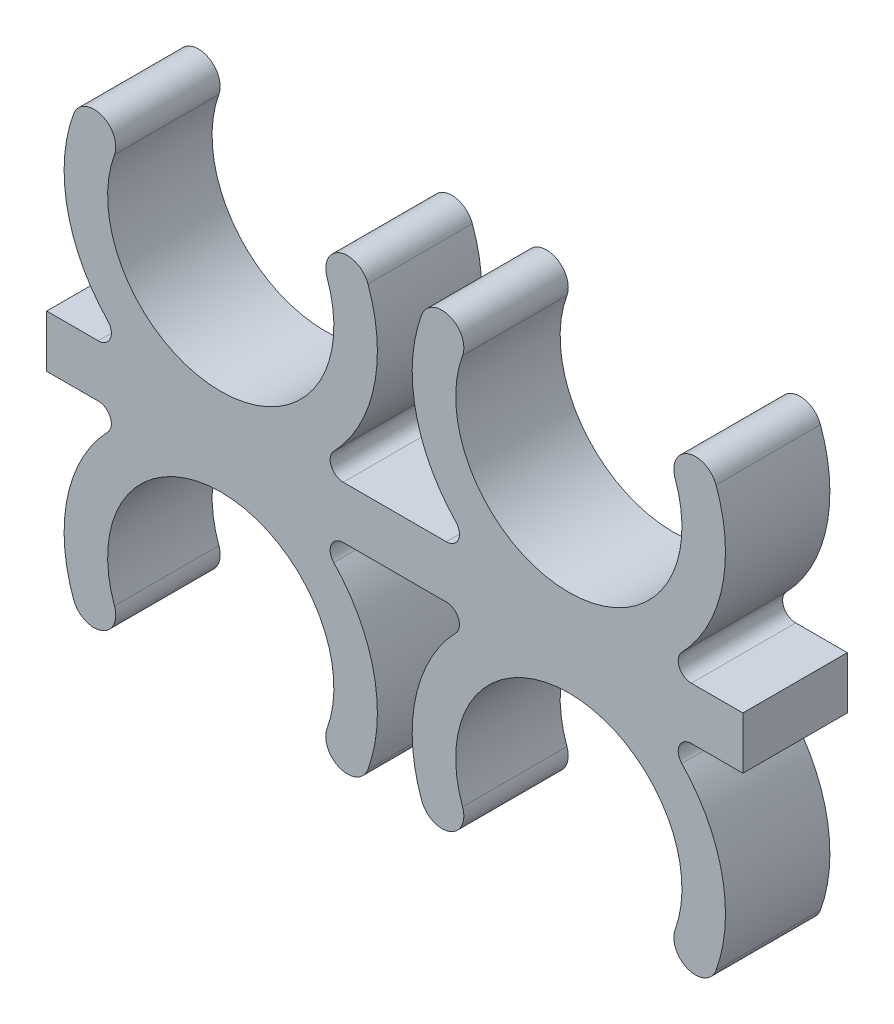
SolidWorks part; units mm, degrees
ref_plane "Front" through (0, 0, 0) normal (0, 0, 1) x (1, 0, 0)
ref_plane "Top" through (0, 0, 0) normal (0, 1, 0) x (1, 0, 0)
ref_plane "Right" through (0, 0, 0) normal (1, 0, 0) x (0, 0, -1)
sketch "Sketch1" plane through (0, 0, 0) normal (0, 0, 1) x (1, 0, 0)
  line L0 (0, -6.5) -> (0, -13.5)
  line L1 (0, 0) -> (-6.108, 2.2231) construction
  line L3 (0, -13.5) -> (-4, -13.5)
  line L4 (-4, -13.5) -> (-4, -10.5)
  line L5 (-4, -10.5) -> (-3.5, -10.5)
  line L6 (-2.5, -9.5) -> (-2.5, -9.3675)
  arc A0 (-6.108, 2.2231) -> (0, -6.5) centre (0, 0) ccw
  arc A1 (-8.4572, 3.0782) -> (-3.15, -8.4307) centre (0, 0) ccw
  arc A2 (-8.4572, 3.0782) -> (-6.108, 2.2231) centre (-7.2826, 2.6507) cw
  arc A3 (-3.5, -10.5) -> (-2.5, -9.5) centre (-3.5, -9.5) ccw
  arc A4 (-2.5, -9.3675) -> (-3.15, -8.4307) centre (-3.5, -9.3675) ccw
  dimension "D1" = 13
  dimension "D2" = 2.5
  dimension "D6" = 1
  dimension "D3" = 70
  dimension "D4" = 3
  dimension "D5" = 7
  dimension "D7" = 4
  dimension "D8" = 0.5
extrude "Boss-Extrude1" add sketch "Sketch1" along normal blind 6
mirror "Mirror1" about plane through (0, -6.5, 6) normal (-1, 0, 0) of "Boss-Extrude1"
sketch "Sketch2" plane through (0, 0, 6) normal (0, 0, 1) x (1, 0, 0)
  line L1 (-10, -13.5) -> (10, -13.5)
  line L2 (-10, -13.5) -> (-10, -10.5)
  line L3 (-10, -10.5) -> (10, -10.5)
  line L4 (10, -13.5) -> (10, -10.5)
  line L5 (-10, -13.5) -> (10, -10.5) construction
  line L6 (-10, -10.5) -> (10, -13.5) construction
  point P0 (0, -12)
  dimension "D1" = 3
  dimension "D2" = 20
extrude "Boss-Extrude2" add sketch "Sketch2" against normal blind 6
sketch "Sketch3" plane through (0, 0, 6) normal (0, 0, 1) x (1, 0, 0)
  line L0 (-5.7078, -19.8012) -> (5.4195, -19.8012) construction
  text T0 "70/2.5" font "Century Gothic" height 3
sketch "Sketch4" plane through (0, 0, 6) normal (0, 0, 1) x (1, 0, 0)
  line L0 (10, -13.5) -> (10, -10.5) construction
  line L1 (-10, -10.5) -> (10, -10.5)
  line L2 (-10, -10.5) -> (-10, -7.5)
  line L3 (-10, -7.5) -> (10, -7.5)
  line L4 (10, -10.5) -> (10, -7.5)
  dimension "D1" = 3
extrude "Boss-Extrude3" add sketch "Sketch4" against normal blind 6
sketch "Sketch5" plane through (0, 0, 6) normal (0, 0, 1) x (1, 0, 0)
  line L1 (-10, -13.5) -> (10, -13.5)
  line L2 (-10, -13.5) -> (-10, -9)
  line L3 (-10, -9) -> (10, -9)
  line L4 (10, -13.5) -> (10, -9)
  dimension "D1" = 4.5
extrude "Cut-Extrude1" cut sketch "Sketch5" against normal through all
fillet "Fillet1" radius 0.75 2 edges at (4.9749, -7.5, 3) (-4.9749, -7.5, 3)
mirror "Mirror2" about plane through (10, -13.5, 0) normal (1, 0, 0)
mirror "Mirror3" about plane through (-10, -9, 0) normal (0, 1, 0)
